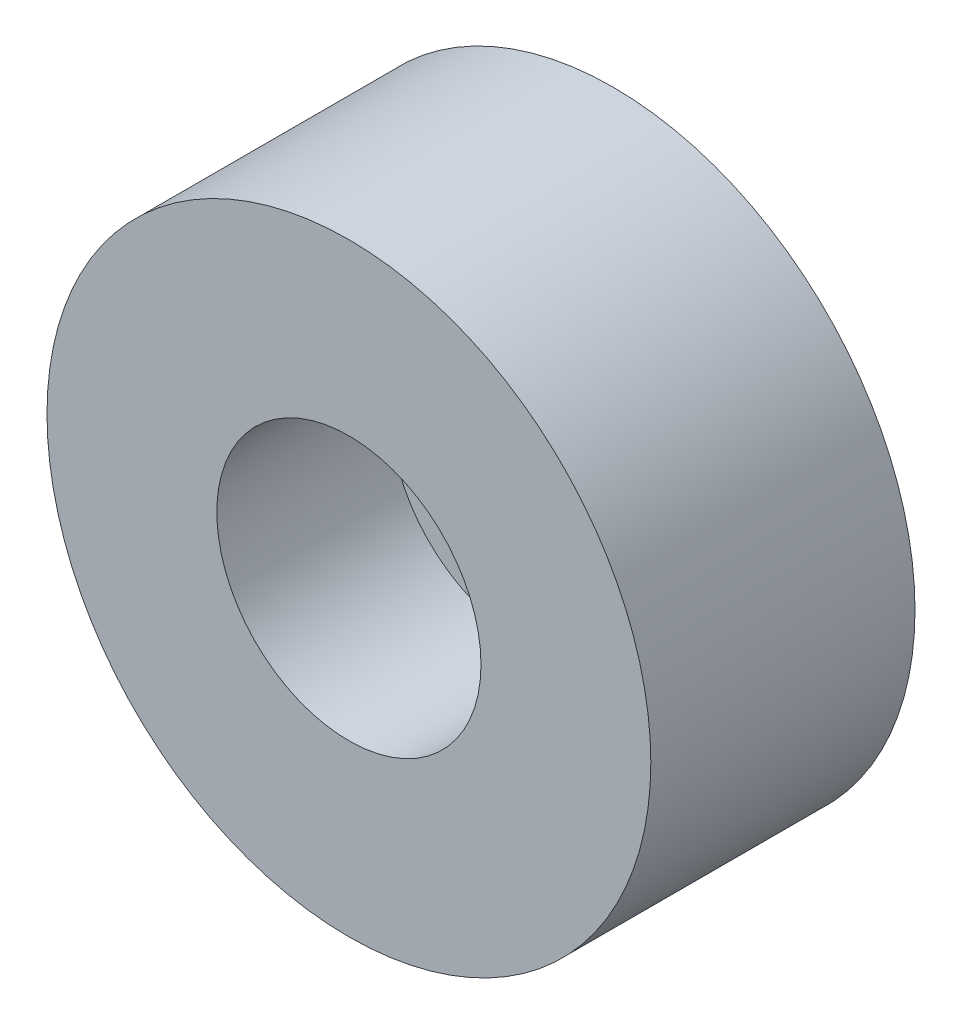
SolidWorks part; units mm, degrees
ref_plane "Front Plane" through (0, 0, 0) normal (0, 0, 1) x (1, 0, 0)
ref_plane "Top Plane" through (0, 0, 0) normal (0, 1, 0) x (1, 0, 0)
ref_plane "Right Plane" through (0, 0, 0) normal (1, 0, 0) x (0, 0, -1)
sketch "Sketch1" plane through (0, 0, 0) normal (0, 0, 1) x (1, 0, 0)
  circle A0 centre (0, 0) radius 10.16
extrude "Boss-Extrude1" add sketch "Sketch1" along normal blind 8.89
sketch "Sketch2" plane through (0, 0, 8.89) normal (0, 0, 1) x (1, 0, 0)
  circle A0 centre (0, 0) radius 4.445
extrude "Cut-Extrude1" cut sketch "Sketch2" against normal blind 5.842
sketch "Sketch3" plane through (0, 0, 3.048) normal (0, 0, 1) x (1, 0, 0)
  circle A0 centre (0, 0) radius 1.651
extrude "Cut-Extrude2" cut sketch "Sketch3" against normal up to surface (3.048 mm away)
